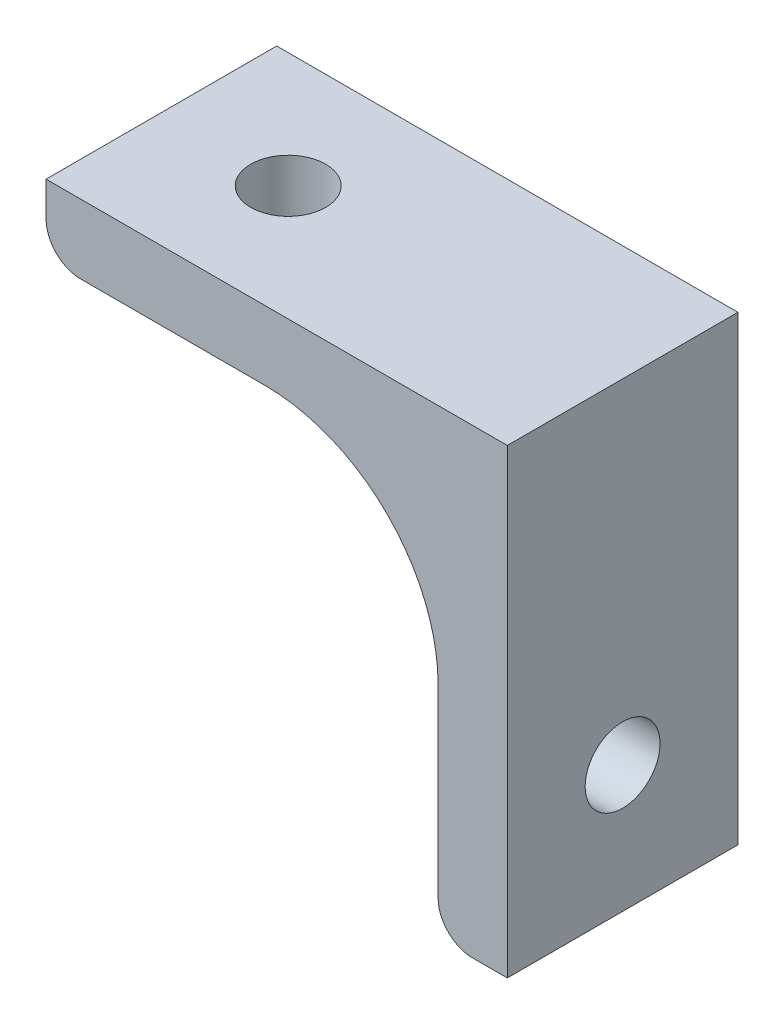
SolidWorks part; units mm, degrees
ref_plane "Alzado" through (0, 0, 0) normal (0, 0, 1) x (1, 0, 0)
ref_plane "Planta" through (0, 0, 0) normal (0, 1, 0) x (1, 0, 0)
ref_plane "Vista lateral" through (0, 0, 0) normal (1, 0, 0) x (0, 0, -1)
sketch "Croquis2" plane through (0, 0, 0) normal (0, 0, 1) x (1, 0, 0)
  line L0 (0, 0) -> (-40, 0)
  line L1 (0, 0) -> (0, -40)
  line L2 (-40, 0) -> (-40, -3)
  line L3 (0, -40) -> (-3, -40)
  line L4 (-37, -6) -> (-21, -6)
  line L5 (-6, -21) -> (-6, -37)
  arc A0 (-6, -21) -> (-21, -6) centre (-21, -21) ccw
  arc A1 (-37, -6) -> (-40, -3) centre (-37, -3) cw
  arc A2 (-3, -40) -> (-6, -37) centre (-3, -37) cw
  dimension "D1" = 15
  dimension "D2" = 3
extrude "Extruir1" add sketch "Croquis2" along normal blind 20
sketch "Croquis3" plane through (0, -6, 0) normal (0, -1, 0) x (1, 0, 0)
  line L0 (-21, 20) -> (-37, 0) construction
  circle A0 centre (-29, 10) radius 3.25
extrude "Cortar-Extruir1" cut sketch "Croquis3" against normal blind 10
sketch "Croquis4" plane through (-6, 0, 0) normal (-1, 0, 0) x (0, 0, 1)
  line L0 (0, -21) -> (20, -37) construction
  circle A0 centre (10, -29) radius 3.25
extrude "Cortar-Extruir2" cut sketch "Croquis4" against normal blind 10
